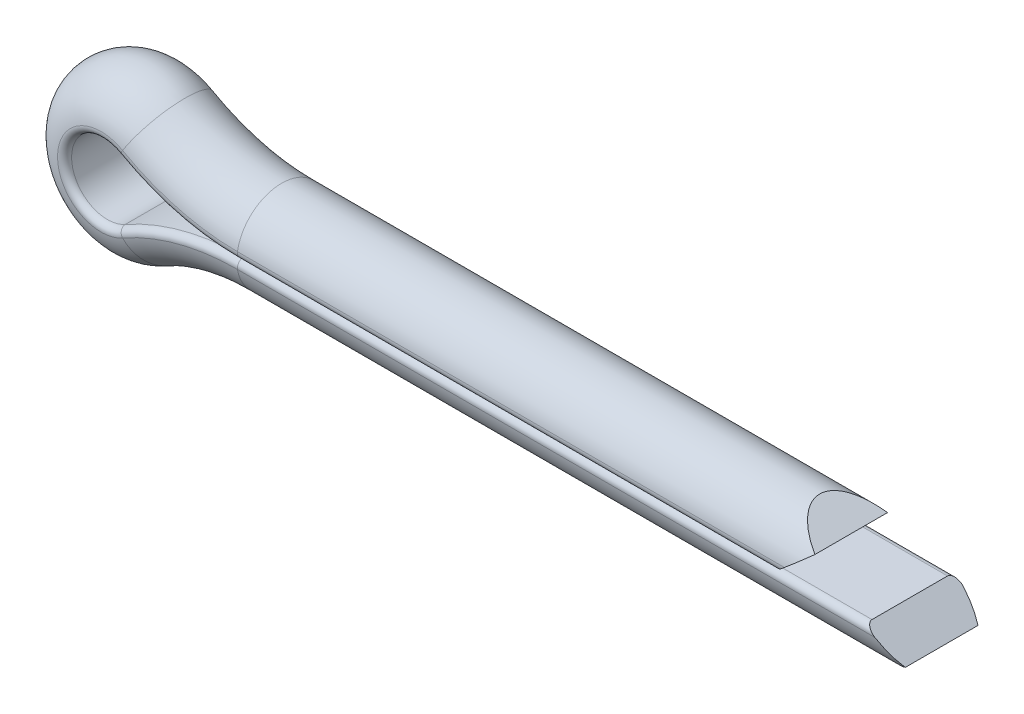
SolidWorks part; units mm, degrees
ref_plane "Front Plane" through (0, 0, 0) normal (0, 0, 1) x (1, 0, 0)
ref_plane "Top Plane" through (0, 0, 0) normal (0, 1, 0) x (1, 0, 0)
ref_plane "Right Plane" through (0, 0, 0) normal (1, 0, 0) x (0, 0, -1)
sketch "PathSke" plane through (0, 0, 0) normal (0, 0, 1) x (1, 0, 0)
  line L0 (0, 0) -> (38.8652, 0) construction
  line L1 (0, 0) -> (0, 12.2501) construction
  line L2 (4.7854, 0) -> (4.7854, 12.2501) construction
  line L3 (4.7854, 1.5748) -> (24.7854, 1.5748)
  line L4 (4.7854, -1.5748) -> (27.9604, -1.5748)
  line L5 (0, 0) -> (-2.8346, 0) construction
  arc A0 (1.3958, 2.4672) -> (1.3958, -2.4672) centre (0, 0) ccw
  arc A1 (4.7854, 1.5748) -> (1.3958, 2.4672) centre (4.7854, 8.4584) cw
  arc A2 (4.7854, -1.5748) -> (1.3958, -2.4672) centre (4.7854, -8.4584) ccw
  dimension "Head_dia" = 5.6693
  dimension "Head_height" = 7.62
  dimension "Diameter" = 3.1496
  dimension "Length" = 20
  dimension "Tip_offset" = 3.175
ref_plane "SectionPlane" through (24.7854, 1.5748, 0) normal (1, 0, 0) x (0, 0, -1)
sketch "SectionSke" plane through (24.7854, 1.5748, 0) normal (1, 0, 0) x (0, 0, -1)
  line L0 (0, -1.5748) -> (0, 8.6928) construction
  line L1 (0, -1.5748) -> (0, 10.6753) construction
  line L2 (-1.45, -1.5748) -> (1.45, -1.5748) construction
  line L3 (-1.3263, -1.5728) -> (1.3263, -1.5728)
  arc A0 (1.5515, -1.305) -> (-1.5515, -1.305) centre (0, -1.5748) ccw
  arc A1 (-1.3263, -1.5728) -> (-1.5515, -1.305) centre (-1.3263, -1.3442) cw
  arc A2 (1.5515, -1.305) -> (1.3263, -1.5728) centre (1.3263, -1.3442) cw
  dimension "D1" = 0.002
  dimension "Diameter" = 3.1496
  dimension "Radius" = 0.2286
sweep "BaseBody" add profiles "SectionSke" path "PathSke"
sketch "ConeCutSke" plane through (0, 0, 0) normal (0, 0, 1) x (1, 0, 0)
  line L0 (0, 0) -> (34.6884, 0) construction
  line L1 (23.6638, 1.5848) -> (27.9704, 1.5848)
  line L2 (27.9704, 1.5848) -> (27.9704, -1.5848)
  line L3 (24.7854, 1.5748) -> (4.7854, 1.5748) construction
  line L4 (23.6638, 1.5848) -> (24.7854, 0.9223)
  line L5 (24.7854, 0.2698) -> (24.7854, 1.5748) construction
  line L6 (24.7854, 0.9223) -> (23.6638, 0)
  line L7 (23.6638, 0) -> (26.8388, 0)
  line L8 (26.8388, 0) -> (27.9604, -0.9223)
  line L9 (27.9604, -1.5748) -> (27.9604, -0.2698) construction
  line L10 (27.9604, -0.9223) -> (26.8388, -1.5848)
  line L11 (26.8388, -1.5848) -> (27.9704, -1.5848)
  point P19 (27.9704, 0)
  dimension "D1" = 0.01
  dimension "D2" = 70
  dimension "D3" = 70
  dimension "D4" = 0.01
extrude "ConeCut" cut sketch "ConeCutSke" against normal through all and the other way through all
equation "\"Diameter@SectionSke\" = \"Diameter@PathSke\""
equation "\"Head_dia@PathSke\" = \"Diameter@PathSke\"*1.8"
